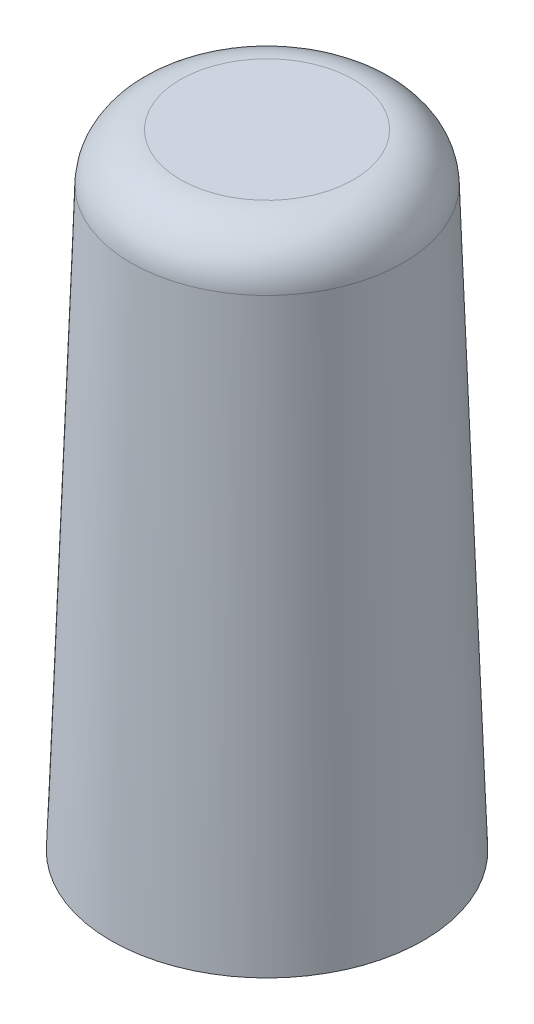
SolidWorks part; units mm, degrees
ref_plane "Front Plane" through (0, 0, 0) normal (0, 0, 1) x (1, 0, 0)
ref_plane "Top Plane" through (0, 0, 0) normal (0, 1, 0) x (1, 0, 0)
ref_plane "Right Plane" through (0, 0, 0) normal (1, 0, 0) x (0, 0, -1)
sketch "Sketch1" plane through (0, 0, 0) normal (0, 1, 0) x (1, 0, 0)
  circle A0 centre (0, 0) radius 9.5
  dimension "D1" = 19
extrude "Boss-Extrude1" add sketch "Sketch1" along normal blind 38 draft 2
fillet "Fillet1" radius 3 1 edges at (0, 38, 8.173)
